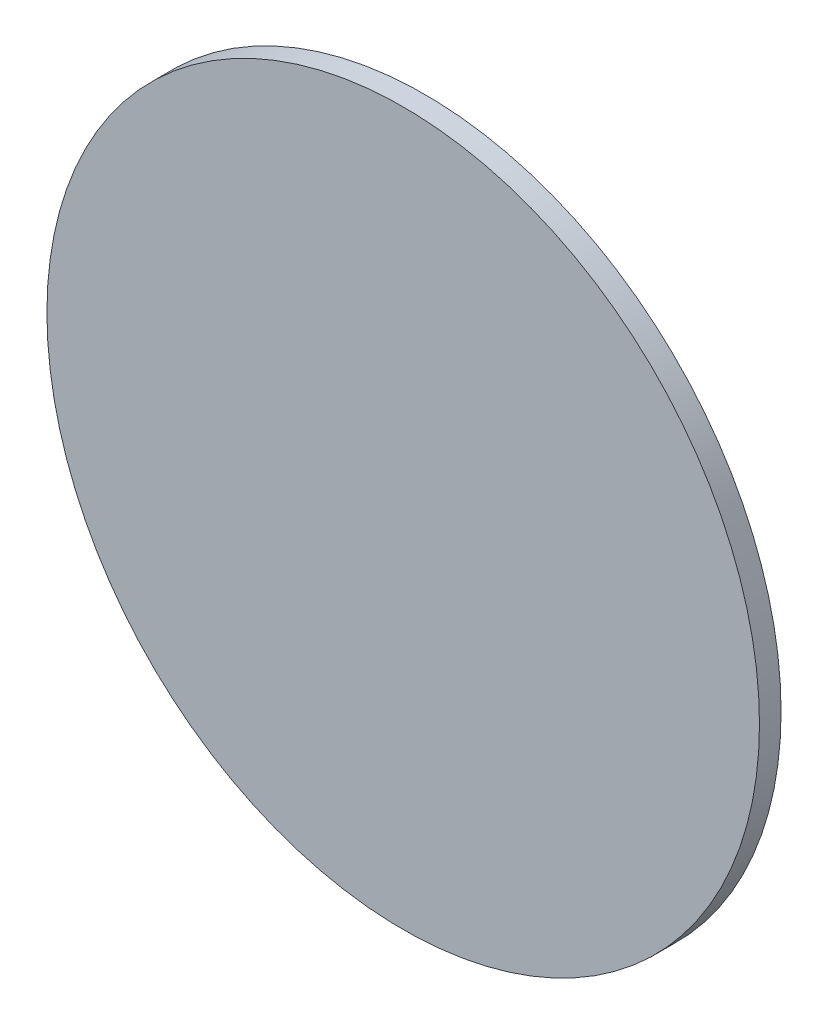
SolidWorks part; units mm, degrees
ref_plane "Alzado" through (0, 0, 0) normal (0, 0, 1) x (1, 0, 0)
ref_plane "Planta" through (0, 0, 0) normal (0, 1, 0) x (1, 0, 0)
ref_plane "Vista lateral" through (0, 0, 0) normal (1, 0, 0) x (0, 0, -1)
sketch "Croquis1" plane through (0, 0, 0) normal (0, 0, 1) x (1, 0, 0)
  circle A0 centre (0, 0) radius 16.5
  dimension "D1" = 33
extrude "Saliente-Extruir1" add sketch "Croquis1" along normal blind 1
